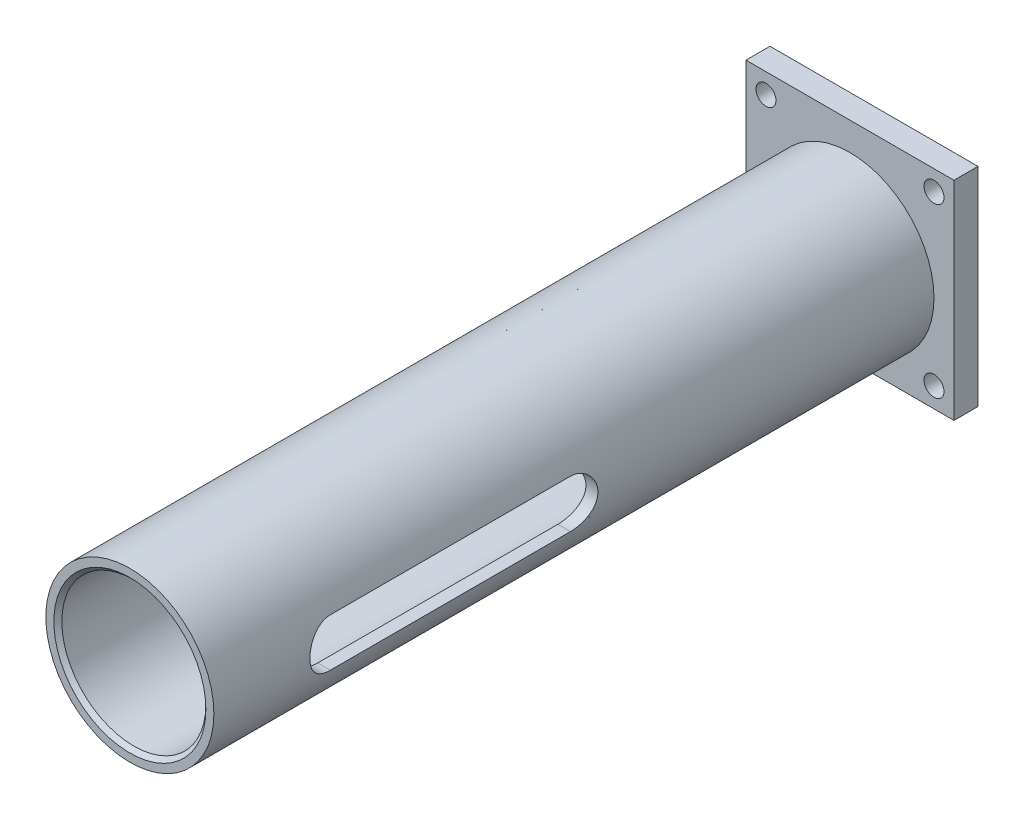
SolidWorks part; units mm, degrees
ref_plane "前视基准面" through (0, 0, 0) normal (0, 0, 1) x (1, 0, 0)
ref_plane "上视基准面" through (0, 0, 0) normal (0, 1, 0) x (1, 0, 0)
ref_plane "右视基准面" through (0, 0, 0) normal (1, 0, 0) x (0, 0, -1)
sketch "草图1" plane through (0, 0, 0) normal (0, 0, 1) x (1, 0, 0)
  line L0 (-43.022, 0) -> (33.8811, 0) construction
  line L1 (-13, 13) -> (13, 13)
  line L2 (-13, 13) -> (-13, -13)
  line L3 (-13, -13) -> (13, -13)
  line L4 (13, 13) -> (13, -13)
  line L5 (-13, 13) -> (13, -13) construction
  line L6 (-13, -13) -> (13, 13) construction
  line L7 (0, 36.5358) -> (0, -22.7559) construction
  line L9 (-10.5, 10.5) -> (10.5, 10.5) construction
  line L10 (-10.5, 10.5) -> (-10.5, -10.5) construction
  line L11 (-10.5, -10.5) -> (10.5, -10.5) construction
  line L12 (10.5, 10.5) -> (10.5, -10.5) construction
  line L13 (-10.5, 10.5) -> (10.5, -10.5) construction
  line L14 (-10.5, -10.5) -> (10.5, 10.5) construction
  circle A0 centre (-10.5, 10.5) radius 1.5
  circle A1 centre (-10.5, -10.5) radius 1.5
  circle A2 centre (10.5, 10.5) radius 1.5
  circle A3 centre (10.5, -10.5) radius 1.5
  circle A4 centre (0, -1) radius 9
  point P0 (0, 0)
  point P10 (0, 0)
  dimension "D4" = 3
  dimension "D5" = 12
  dimension "D6" = 18
  dimension "D7" = 3
  dimension "D1" = 26
  dimension "D2" = 26
  dimension "D3" = 21
extrude "凸台-拉伸1" add sketch "草图1" along normal blind 3
sketch "草图2" plane through (0, 0, 0) normal (0, 0, -1) x (-1, 0, 0)
  circle A0 centre (0, -1) radius 9
  circle A1 centre (0, -1) radius 11.15
  dimension "D1" = 22.3
extrude "凸台-拉伸2" add sketch "草图2" along normal blind 2
sketch "草图3" plane through (0, 0, 3) normal (0, 0, 1) x (1, 0, 0)
  circle A0 centre (0, -1) radius 9
  circle A1 centre (0, -1) radius 10.5
  dimension "D1" = 21
extrude "凸台-拉伸3" add sketch "草图3" along normal blind 90
fillet "圆角1" radius 0.5 1 edges at (-11.15, -1, -2)
sketch "草图4" plane through (0, 0, 0) normal (1, 0, 0) x (0, 0, -1)
  line L0 (-93, -1) -> (15.839, -1) construction
  line L1 (-93, 9.5) -> (-93, -11.5) construction
  line L2 (-78, -1) -> (-48, -1) construction
  line L3 (-78, 2) -> (-48, 2)
  line L4 (-78, -4) -> (-48, -4)
  arc A0 (-78, 2) -> (-78, -4) centre (-78, -1) ccw
  arc A1 (-48, -4) -> (-48, 2) centre (-48, -1) ccw
  point P6 (-63, -1)
  dimension "D1" = 30
  dimension "D2" = 6
  dimension "D3" = 15
extrude "切除-拉伸1" cut sketch "草图4" against normal mid plane 30
chamfer "倒角1" distance 0.5 angle 45 1 edges at (9, -1, 93)
sketch "草图5" plane through (0, 0, 3) normal (0, 0, 1) x (1, 0, 0)
  circle A0 centre (10.5, 10.5) radius 1.25
  circle A1 centre (-10.5, -10.5) radius 1.25
  circle A2 centre (-10.5, -10.5) radius 1.5 construction
  circle A3 centre (10.5, 10.5) radius 1.5 construction
  circle A4 centre (-10.5, -10.5) radius 1.5
  circle A5 centre (10.5, 10.5) radius 1.5
  circle A6 centre (-10.5, 10.5) radius 1.25
  circle A7 centre (-10.5, 10.5) radius 1.5
  circle A8 centre (10.5, -10.5) radius 1.25
  circle A9 centre (10.5, -10.5) radius 1.5
  dimension "D1" = 2.5
extrude "凸台-拉伸4" add sketch "草图5" against normal up to surface (3 mm away)
